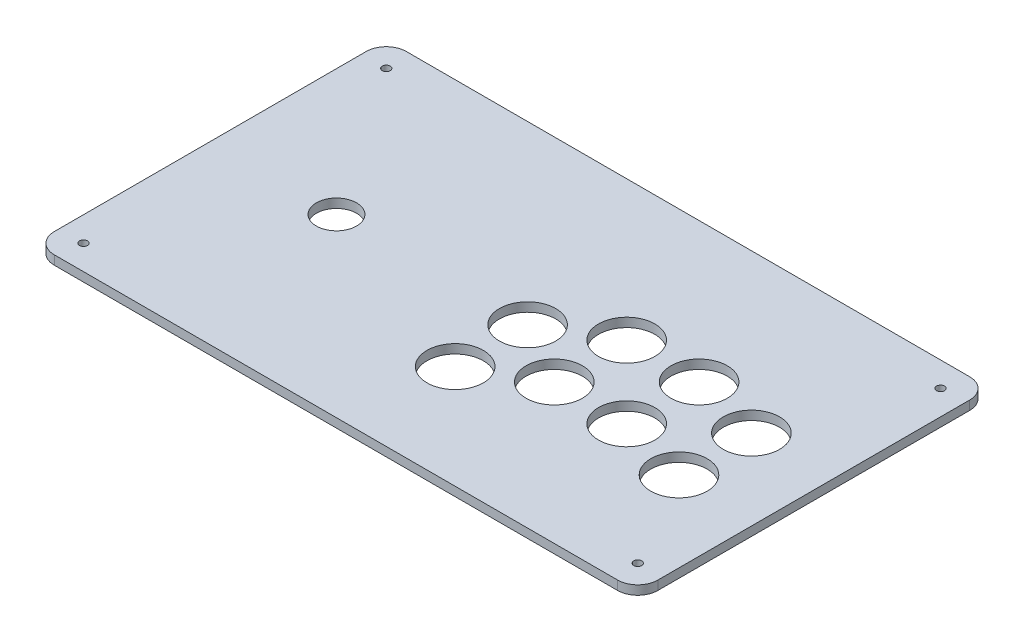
SolidWorks part; units mm, degrees
ref_plane "Front Plane" through (0, 0, 0) normal (0, 0, 1) x (1, 0, 0)
ref_plane "Top Plane" through (0, 0, 0) normal (0, 1, 0) x (1, 0, 0)
ref_plane "Right Plane" through (0, 0, 0) normal (1, 0, 0) x (0, 0, -1)
sketch "Sketch1" plane through (0, 0, 0) normal (0, 1, 0) x (1, 0, 0)
  line L0 (-150, 0) -> (150, 0) construction
  line L1 (140, -87.5) -> (-140, -87.5)
  line L2 (150, -77.5) -> (150, 77.5)
  line L3 (140, 87.5) -> (-140, 87.5)
  line L4 (-150, -77.5) -> (-150, 77.5)
  line L5 (150, -87.5) -> (-150, 87.5) construction
  line L6 (150, 87.5) -> (-150, -87.5) construction
  circle A0 centre (7.75, 0) radius 14
  circle A1 centre (39, 18) radius 14
  circle A2 centre (75, 18) radius 14
  circle A3 centre (110, 9) radius 14
  circle A4 centre (7.75, -36) radius 14
  circle A5 centre (39, -18) radius 14
  circle A6 centre (75, -18) radius 14
  circle A7 centre (110, -27) radius 14
  circle A8 centre (-87.25, 0) radius 10
  arc A9 (140, -87.5) -> (150, -77.5) centre (140, -77.5) ccw
  arc A10 (150, 77.5) -> (140, 87.5) centre (140, 77.5) ccw
  arc A11 (-140, -87.5) -> (-150, -77.5) centre (-140, -77.5) cw
  arc A12 (-140, 87.5) -> (-150, 77.5) centre (-140, 77.5) ccw
  point P0 (0, 0)
  dimension "D3" = 28
  dimension "D4" = 20
  dimension "D16" = 10
  dimension "D1" = 300
  dimension "D2" = 175
  dimension "D5" = 36
  dimension "D6" = 18
  dimension "D7" = 36
  dimension "D8" = 31.25
  dimension "D9" = 36
  dimension "D10" = 9
  dimension "D11" = 36
  dimension "D12" = 35
  dimension "D13" = 18
  dimension "D14" = 40
  dimension "D15" = 95
extrude "Boss-Extrude1" add sketch "Sketch1" along normal blind 4.5
sketch "Sketch3" plane through (0, 4.5, 0) normal (0, 1, 0) x (1, 0, 0)
  line L0 (-150, 77.5) -> (-150, -77.5) construction
  line L1 (-140, -87.5) -> (140, -87.5) construction
  line L3 (140, 87.5) -> (-140, 87.5) construction
  line L4 (150, -77.5) -> (150, 77.5) construction
  circle A0 centre (-137.75, 75.25) radius 2
  circle A1 centre (137.75, 75.25) radius 2
  circle A2 centre (137.75, -75.25) radius 2
  circle A3 centre (-137.75, -75.25) radius 2
  point P12 (0, 0)
  point P13 (0, 0)
  point P14 (0, 0)
  point P17 (0, 0)
  point P20 (0, 0)
  dimension "D1" = 4
  dimension "D2" = 12.25
  dimension "D3" = 12.25
  dimension "D4" = 12.25
  dimension "D5" = 12.25
extrude "Cut-Extrude1" cut sketch "Sketch3" against normal through all
